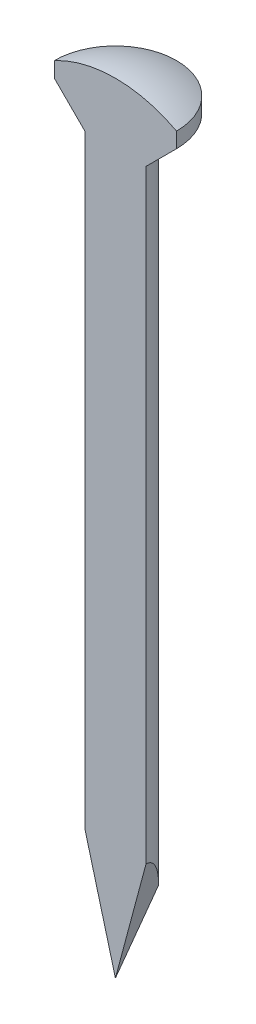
SolidWorks part; units mm, degrees
ref_plane "face" through (0, 0, 0) normal (0, 0, 1) x (1, 0, 0)
ref_plane "dessus" through (0, 0, 0) normal (0, 1, 0) x (1, 0, 0)
ref_plane "profil" through (0, 0, 0) normal (1, 0, 0) x (0, 0, -1)
sketch "Esquisse1" plane through (0, 0, 0) normal (0, 0, 1) x (1, 0, 0)
  line L0 (0, 0) -> (0, 25)
  line L1 (0, 0) -> (1, 0)
  line L2 (1, 0) -> (1, 23.5)
  line L3 (1, 23.5) -> (2, 24.5)
  line L4 (0, 31.5099) -> (0, -2.2698) construction
  line L5 (2, 24.5) -> (2, 25)
  line L7 (2, 25) -> (0, 25)
  dimension "D1" = 1
  dimension "D2" = 1
  dimension "D3" = 2
  dimension "D4" = 0.5
  dimension "D5" = 25
revolve "Base-Révolution" add sketch "Esquisse1" angle 360 about L4
dome "Dôme2" faces to dome 1 distance 0.5 parameters "D1"=0.5
sketch "Esquisse2" plane through (0, 0, 0) normal (0, 0, 1) x (1, 0, 0)
  line L0 (1, 0) -> (1, 3.7283)
  line L4 (-1, 0) -> (1, 0) construction
  line L6 (1, 0) -> (1, 23.5) construction
  line L7 (1, 3.7283) -> (0.001, 0)
  line L8 (0.001, 0) -> (1, 0)
  dimension "D1" = 0.999
  dimension "D2" = 75
extrude "Enlèv. mat.-Extru.1" cut sketch "Esquisse2" against normal mid plane 5
pattern_circular "Répétition circulaire2" count 4 over 360 about axis through (0, 31.5099, 0) along (0, -1, 0)
sketch "Esquisse4" plane through (0, 0, 0) normal (0, 0, 1) x (1, 0, 0)
  line L1 (-2.6329, 26.1316) -> (2.4396, 26.1316)
  line L2 (-2.6329, 26.1316) -> (-2.6329, -0.3901)
  line L3 (-2.6329, -0.3901) -> (2.4396, -0.3901)
  line L4 (2.4396, 26.1316) -> (2.4396, -0.3901)
extrude "Enlèv. mat.-Extru.3" cut sketch "Esquisse4" along normal up to next
